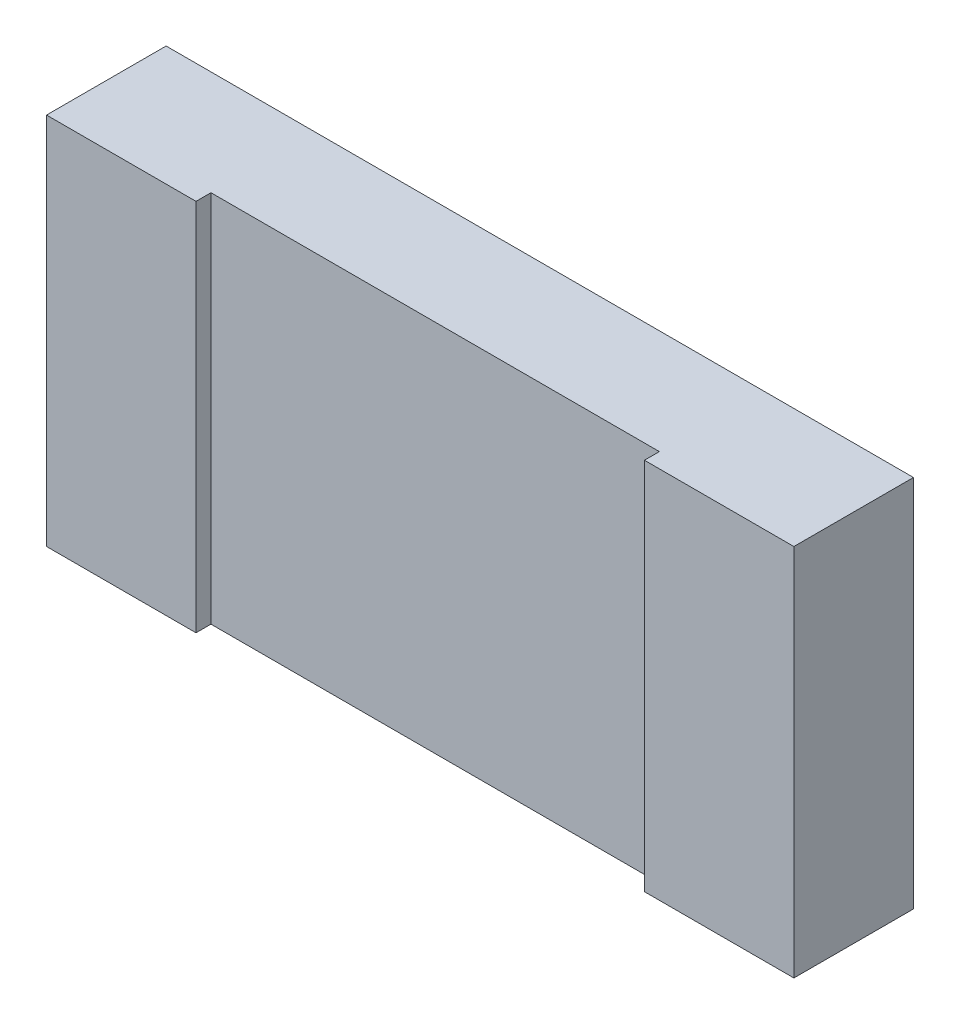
SolidWorks part; units mm, degrees
ref_plane "Plane1" through (0, 0, 0) normal (0, 0, 1) x (1, 0, 0)
ref_plane "Plane2" through (0, 0, 0) normal (0, 1, 0) x (1, 0, 0)
ref_plane "Plane3" through (0, 0, 0) normal (1, 0, 0) x (0, 0, -1)
sketch "Sketch1" plane through (0, 0, 0) normal (0, 0, 1) x (1, 0, 0)
  line L0 (0, 0) -> (2.5, 0)
  line L1 (0, 0) -> (0, 1.25)
  line L2 (2.5, 1.25) -> (0, 1.25)
  line L3 (2.5, 1.25) -> (2.5, 0)
extrude "Base-Extrude" add sketch "Sketch1" along normal blind 0.4
sketch "Sketch2" plane through (0, 0, 0) normal (0, 1, 0) x (1, 0, 0)
  line L0 (0.5, -0.35) -> (2, -0.35)
  line L1 (0.5, -0.35) -> (0.5, -0.65)
  line L2 (2, -0.65) -> (0.5, -0.65)
  line L3 (2, -0.65) -> (2, -0.35)
extrude "Cut-Extrude1" cut sketch "Sketch2" along normal blind 6.5
